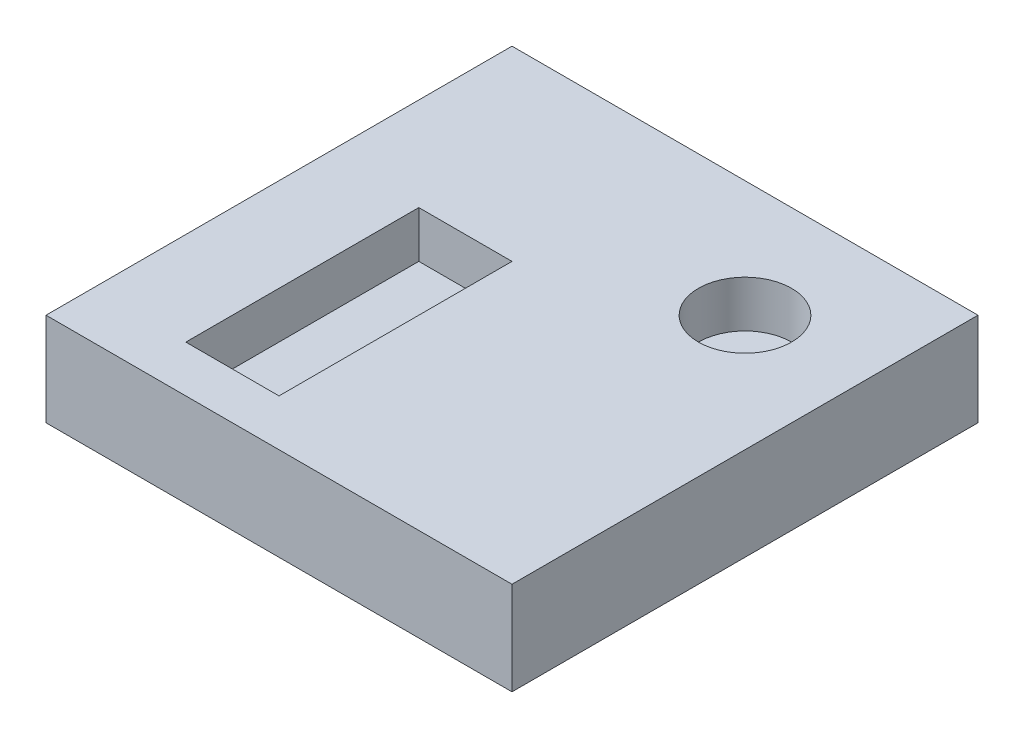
SolidWorks part; units mm, degrees
ref_plane "Ebene vorne" through (0, 0, 0) normal (0, 0, 1) x (1, 0, 0)
ref_plane "Ebene oben" through (0, 0, 0) normal (0, 1, 0) x (1, 0, 0)
ref_plane "Ebene rechts" through (0, 0, 0) normal (1, 0, 0) x (0, 0, -1)
sketch "Skizze1" plane through (0, 0, 0) normal (0, 1, 0) x (1, 0, 0)
  line L1 (0, 0) -> (-100, 0)
  line L2 (0, 0) -> (0, 100)
  line L3 (0, 100) -> (-100, 100)
  line L4 (-100, 0) -> (-100, 100)
  dimension "D1" = 100
  dimension "D2" = 100
extrude "Aufsatz-Linear austragen1" add sketch "Skizze1" along normal blind 20
sketch "Skizze2" plane through (0, 20, 0) normal (0, 1, 0) x (1, 0, 0)
  line L0 (-100, 0) -> (0, 0) construction
  line L1 (-80, 60) -> (-60, 60)
  line L2 (-80, 60) -> (-80, 10)
  line L3 (-80, 10) -> (-60, 10)
  line L4 (-60, 60) -> (-60, 10)
  line L5 (-100, 100) -> (-100, 0) construction
  dimension "D1" = 50
  dimension "D2" = 20
  dimension "D3" = 10
  dimension "D4" = 20
extrude "Schnitt-Linear austragen1" cut sketch "Skizze2" against normal blind 10
sketch "Skizze3" plane through (0, 20, 0) normal (0, 1, 0) x (1, 0, 0)
  line L0 (0, 0) -> (0, 100) construction
  line L1 (0, 100) -> (-100, 100) construction
  circle A0 centre (-25, 75) radius 10
  dimension "D1" = 20
  dimension "D2" = 25
  dimension "D3" = 25
extrude "Schnitt-Linear austragen2" cut sketch "Skizze3" against normal blind 10
